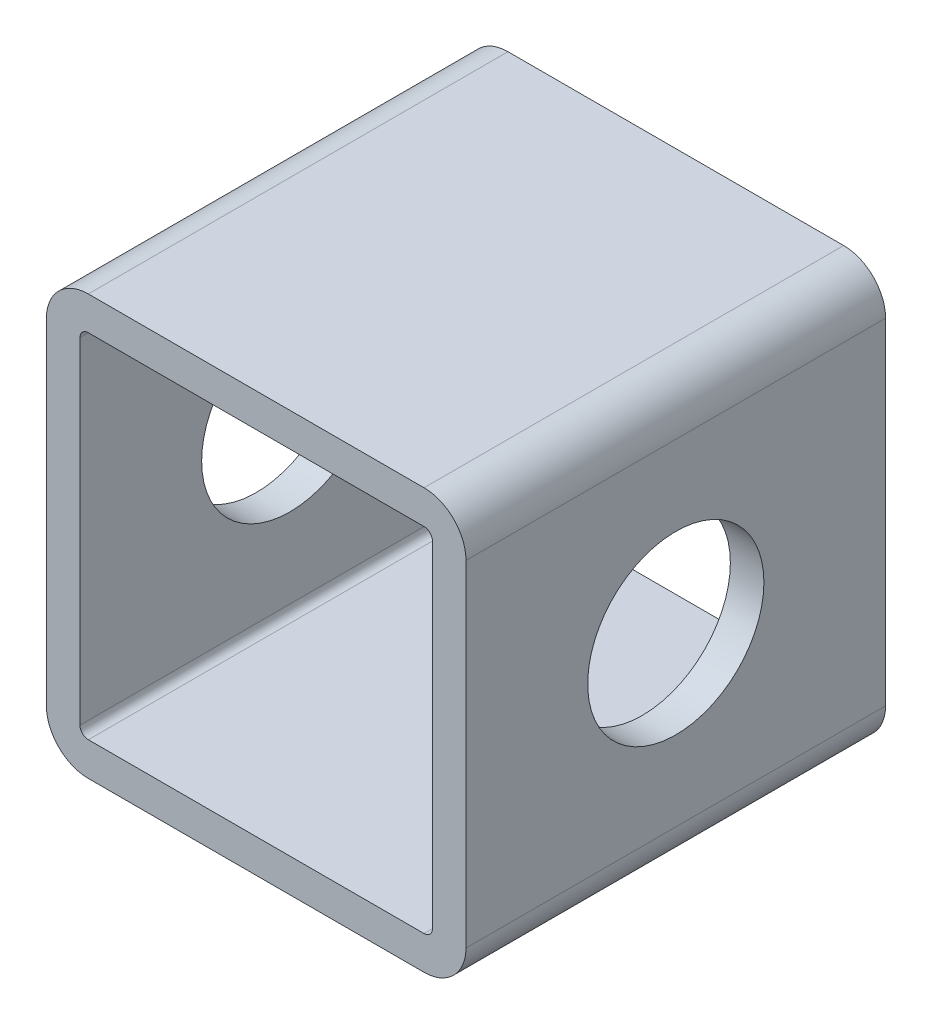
SolidWorks part; units mm, degrees
ref_plane "Face" through (0, 0, 0) normal (0, 0, 1) x (1, 0, 0)
ref_plane "Dessus" through (0, 0, 0) normal (0, 1, 0) x (1, 0, 0)
ref_plane "Droite" through (0, 0, 0) normal (1, 0, 0) x (0, 0, -1)
sketch "Esquisse1" plane through (0, 0, 0) normal (0, 0, 1) x (1, 0, 0)
  line L0 (4, -5) -> (4, -45)
  line L1 (5, 0) -> (45, 0)
  line L2 (0, -5) -> (0, -45)
  line L3 (5, -50) -> (45, -50)
  line L4 (50, -5) -> (50, -45)
  line L5 (5, -46) -> (45, -46)
  line L6 (46, -5) -> (46, -45)
  line L7 (5, -4) -> (45, -4)
  arc A0 (45, -50) -> (50, -45) centre (45, -45) ccw
  arc A1 (5, -50) -> (0, -45) centre (5, -45) cw
  arc A2 (0, -5) -> (5, 0) centre (5, -5) cw
  arc A3 (45, 0) -> (50, -5) centre (45, -5) cw
  arc A4 (5, -46) -> (4, -45) centre (5, -45) cw
  arc A5 (45, -46) -> (46, -45) centre (45, -45) ccw
  arc A6 (45, -4) -> (46, -5) centre (45, -5) cw
  arc A7 (4, -5) -> (5, -4) centre (5, -5) cw
  point P9 (0, -50)
  point P12 (0, 0)
  point P15 (50, 0)
  dimension "D3" = 5
  dimension "D1" = 50
  dimension "D2" = 50
  dimension "D4" = 4
extrude "Base-Extrusion" add sketch "Esquisse1" along normal blind 50
sketch "Esquisse2" plane through (50, 0, 0) normal (1, 0, 0) x (0, 0, -1)
  line L0 (-50, -45) -> (-50, -5) construction
  line L1 (-50, 0) -> (0, 0) construction
  circle A0 centre (-25, -25) radius 10.5
  dimension "D1" = 21
  dimension "D2" = 25
  dimension "D3" = 25
extrude "Enlèv. mat.-Extru.1" cut sketch "Esquisse2" against normal through all
